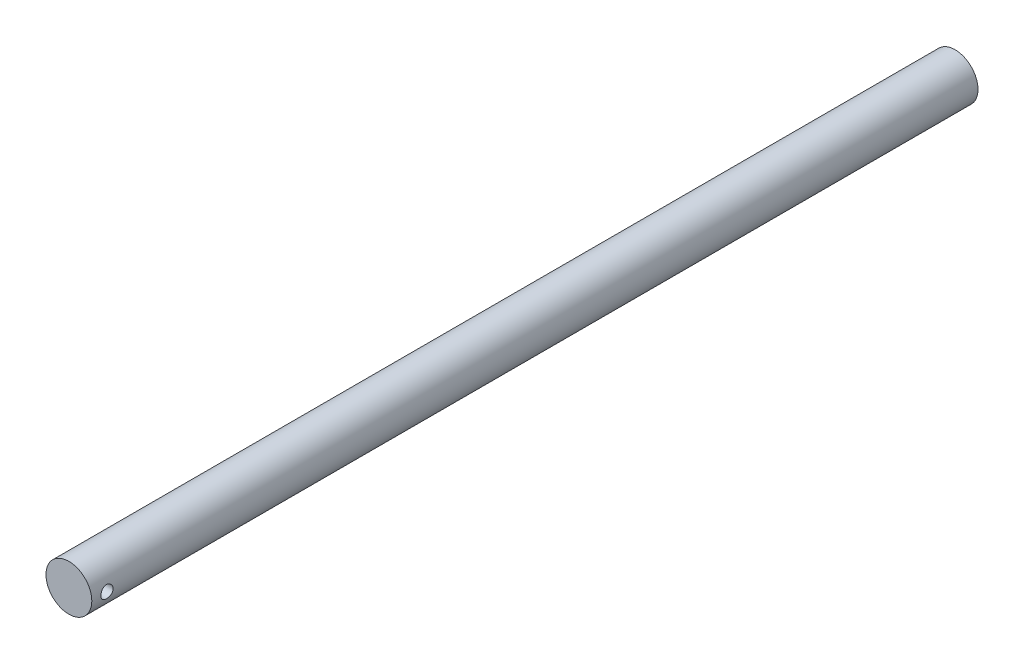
SolidWorks part; units mm, degrees
ref_plane "Plan1" through (0, 0, 0) normal (0, 0, 1) x (1, 0, 0)
ref_plane "Plan2" through (0, 0, 0) normal (0, 1, 0) x (1, 0, 0)
ref_plane "Plan3" through (0, 0, 0) normal (1, 0, 0) x (0, 0, -1)
sketch "Esquisse1" plane through (0, 0, 0) normal (0, 0, 1) x (1, 0, 0)
  circle A0 centre (0, 0) radius 0.75
  dimension "D1" = 1.5
extrude "Base-Extrusion" add sketch "Esquisse1" along normal blind 29
sketch "Esquisse5" plane through (0, 0, 0) normal (1, 0, 0) x (0, 0, -1)
  line L0 (0, 0) -> (-21.2418, 0) construction
  line L1 (-15.75, 0) -> (-4.25, 0) construction
  circle A0 centre (-28.5, 0) radius 0.2
  dimension "D1" = 0.4
  dimension "D2" = 28.5
extrude "Enlèv. mat.-Extru.2" cut sketch "Esquisse5" against normal mid plane 2
